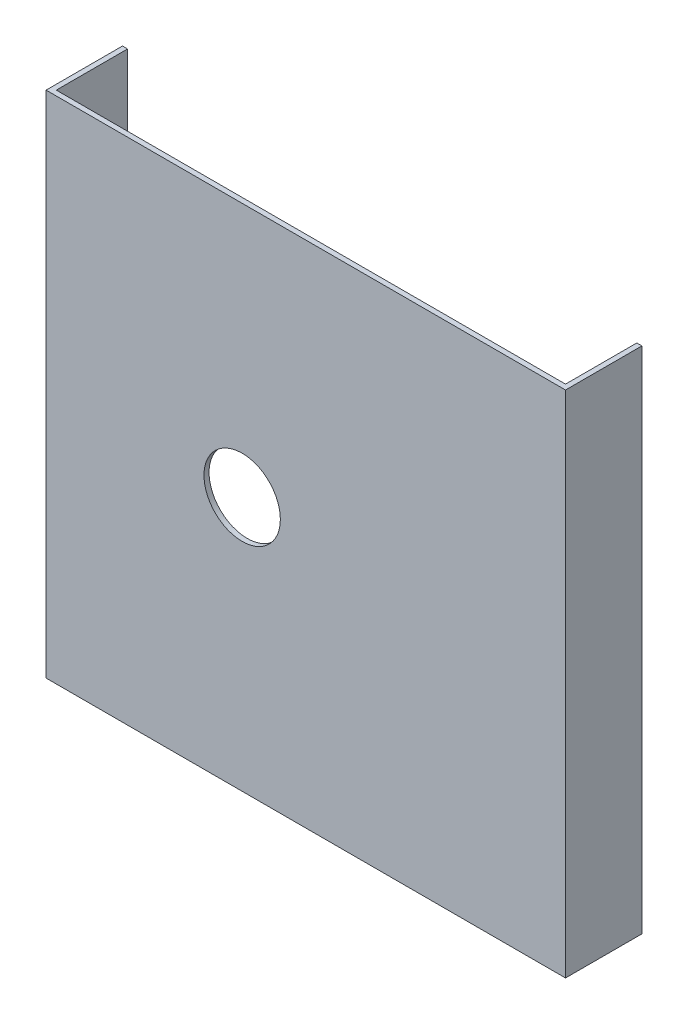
SolidWorks part; units mm, degrees
ref_plane "Piano frontale" through (0, 0, 0) normal (0, 0, 1) x (1, 0, 0)
ref_plane "Piano superiore" through (0, 0, 0) normal (0, 1, 0) x (1, 0, 0)
ref_plane "Piano destro" through (0, 0, 0) normal (1, 0, 0) x (0, 0, -1)
sketch "Schizzo1" plane through (0, 0, 0) normal (0, 0, 1) x (1, 0, 0)
  line L1 (-100, -100) -> (100, -100)
  line L2 (-100, -100) -> (-100, 100)
  line L3 (-100, 100) -> (100, 100)
  line L4 (100, -100) -> (100, 100)
  line L5 (-100, -100) -> (100, 100) construction
  line L6 (-100, 100) -> (100, -100) construction
  circle A1 centre (-25, 0) radius 15
  point P0 (0, 0)
  dimension "D3" = 75
  dimension "D4" = 30
  dimension "D1" = 200
  dimension "D2" = 200
extrude "Estrusione-Estrusione1" add sketch "Schizzo1" along normal blind 2
sketch "Schizzo3" plane through (-100, 0, 0) normal (-1, 0, 0) x (0, 0, 1)
  line L0 (2, -100) -> (0, -100) construction
  line L1 (2, 100) -> (-28, 100)
  line L2 (2, 100) -> (2, -100)
  line L3 (2, -100) -> (-28, -100)
  line L4 (-28, 100) -> (-28, -100)
  dimension "D1" = 30
extrude "Estrusione-Estrusione2" add sketch "Schizzo3" along normal blind 2
ref_plane "Piano1" through (0, 0, 0) normal (1, 0, 0) x (0, 0, -1)
mirror "Specchia1" about plane through (0, 0, 0) normal (1, 0, 0) of "Estrusione-Estrusione2"
